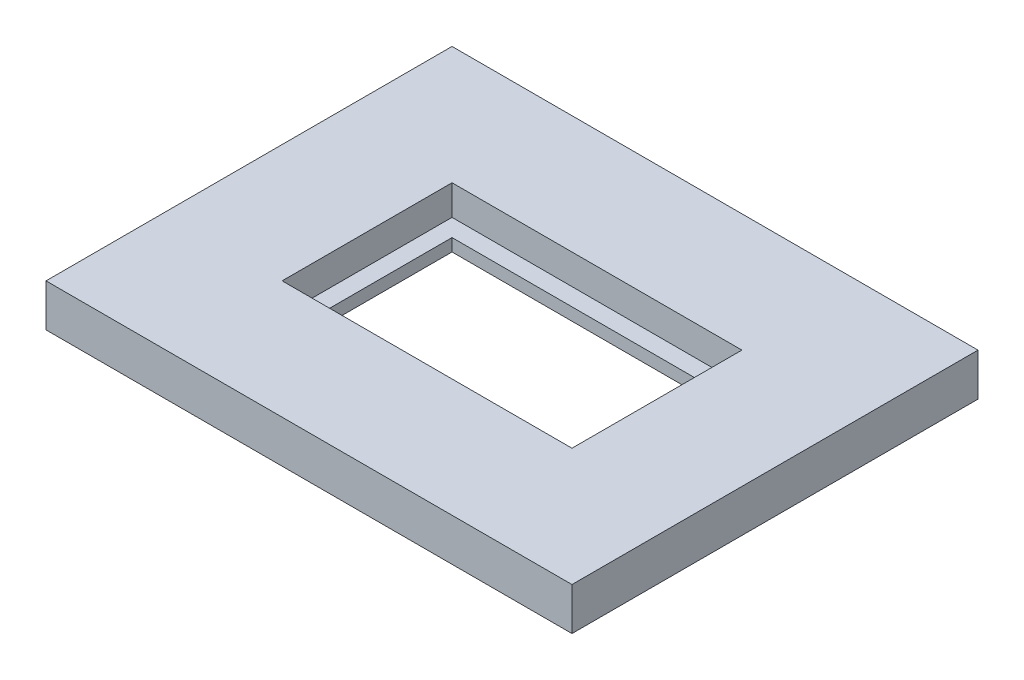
SolidWorks part; units mm, degrees
ref_plane "Front Plane" through (0, 0, 0) normal (0, 0, 1) x (1, 0, 0)
ref_plane "Top Plane" through (0, 0, 0) normal (0, 1, 0) x (1, 0, 0)
ref_plane "Right Plane" through (0, 0, 0) normal (1, 0, 0) x (0, 0, -1)
sketch "Sketch1" plane through (0, 0, 0) normal (0, 1, 0) x (1, 0, 0)
  line L1 (92.075, -53.975) -> (-92.075, -53.975)
  line L2 (92.075, -53.975) -> (92.075, 53.975)
  line L3 (92.075, 53.975) -> (-92.075, 53.975)
  line L4 (-92.075, -53.975) -> (-92.075, 53.975)
  line L5 (92.075, -53.975) -> (-92.075, 53.975) construction
  line L6 (92.075, 53.975) -> (-92.075, -53.975) construction
  line L7 (167.075, -128.975) -> (-167.075, -128.975)
  line L8 (167.075, -128.975) -> (167.075, 128.975)
  line L9 (167.075, 128.975) -> (-167.075, 128.975)
  line L10 (-167.075, -128.975) -> (-167.075, 128.975)
  line L11 (167.075, -128.975) -> (-167.075, 128.975) construction
  line L12 (167.075, 128.975) -> (-167.075, -128.975) construction
  point P0 (0, 0)
  point P6 (0, 0)
  dimension "D1" = 107.95
  dimension "D2" = 184.15
  dimension "D3" = 75
  dimension "D4" = 75
extrude "Boss-Extrude1" add sketch "Sketch1" along normal blind 19.05
sketch "Sketch2" plane through (0, 0, 0) normal (0, -1, 0) x (1, 0, 0)
  line L0 (-80.9625, 42.8625) -> (-80.9625, -42.8625)
  line L1 (-92.075, 53.975) -> (92.075, 53.975) construction
  line L2 (-92.075, 53.975) -> (-92.075, -53.975) construction
  line L3 (-92.075, -53.975) -> (92.075, -53.975) construction
  line L4 (92.075, 53.975) -> (92.075, -53.975) construction
  line L5 (-80.9625, -42.8625) -> (80.9625, -42.8625)
  line L6 (80.9625, 42.8625) -> (80.9625, -42.8625)
  line L7 (-80.9625, 42.8625) -> (80.9625, 42.8625)
  line L9 (-167.075, 128.975) -> (167.075, 128.975)
  line L10 (-167.075, 128.975) -> (-167.075, -128.975)
  line L11 (-167.075, -128.975) -> (167.075, -128.975)
  line L12 (167.075, 128.975) -> (167.075, -128.975)
  dimension "D1" = 11.1125
extrude "Boss-Extrude2" add sketch "Sketch2" along normal blind 7.9375
